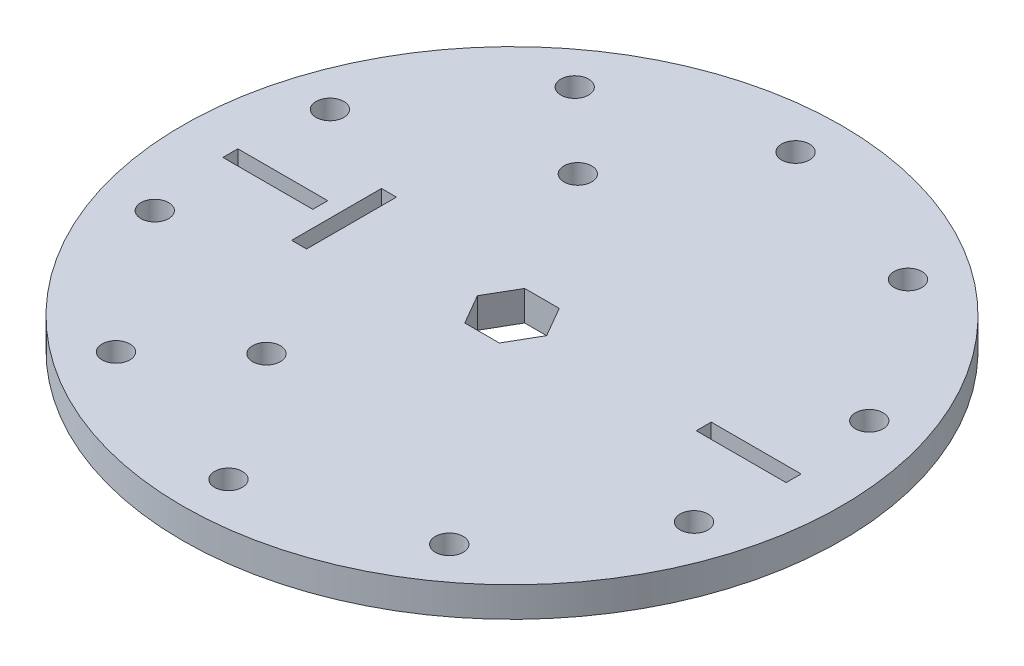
SolidWorks part; units mm, degrees
ref_plane "Front Plane" through (0, 0, 0) normal (0, 0, 1) x (1, 0, 0)
ref_plane "Top Plane" through (0, 0, 0) normal (0, 1, 0) x (1, 0, 0)
ref_plane "Right Plane" through (0, 0, 0) normal (1, 0, 0) x (0, 0, -1)
sketch "Sketch1" plane through (0, 0, 0) normal (0, 1, 0) x (1, 0, 0)
  line L1 (1.8331, 3.175) -> (-1.8331, 3.175)
  line L2 (-1.8331, 3.175) -> (-3.6662, 0)
  line L3 (-3.6662, 0) -> (-1.8331, -3.175)
  line L4 (-1.8331, -3.175) -> (1.8331, -3.175)
  line L5 (1.8331, -3.175) -> (3.6662, 0)
  line L6 (3.6662, 0) -> (1.8331, 3.175)
  circle A0 centre (0, 0) radius 34.925
  circle A1 centre (0, 0) radius 3.175 construction
  dimension "D1" = 69.85
  dimension "D2" = 6.35
extrude "Boss-Extrude1" add sketch "Sketch1" along normal blind 3.175
hole_wizard "#4 Clearance Hole1" positions "Sketch4" profile "Sketch2" hole size "#4" standard "ANSI Inch"
sketch "Sketch4" plane through (0, 3.175, 0) normal (0, 1, 0) x (1, 0, 0)
  line L1 (0, 30.0455) -> (-17.6603, 24.3073) construction
  line L2 (-17.6603, 24.3073) -> (-28.575, 9.2846) construction
  line L3 (-28.575, 9.2846) -> (-28.575, -9.2846) construction
  line L4 (-28.575, -9.2846) -> (-17.6603, -24.3073) construction
  line L5 (-17.6603, -24.3073) -> (0, -30.0455) construction
  line L6 (0, -30.0455) -> (17.6603, -24.3073) construction
  line L7 (17.6603, -24.3073) -> (28.575, -9.2846) construction
  line L8 (28.575, -9.2846) -> (28.575, 9.2846) construction
  line L9 (28.575, 9.2846) -> (17.6603, 24.3073) construction
  line L10 (17.6603, 24.3073) -> (0, 30.0455) construction
  line L12 (0, 0) -> (28.575, 9.2846) construction
  line L20 (34.925, 0) -> (0, 0) construction
  circle A0 centre (0, 0) radius 28.575 construction
  circle A1 centre (0, 0) radius 34.925 construction
  point P3 (0, 30.0455)
  point P4 (-17.6603, 24.3073)
  point P5 (-28.575, 9.2846)
  point P6 (-28.575, -9.2846)
  point P7 (-17.6603, -24.3073)
  point P8 (0, -30.0455)
  point P9 (17.6603, -24.3073)
  point P10 (28.575, -9.2846)
  point P11 (28.575, 9.2846)
  point P12 (17.6603, 24.3073)
  dimension "D1" = 57.15
  dimension "D2" = 18
sketch "Sketch2" plane through (0, 3.175, -30.0455) normal (1, 0, 0) x (0, 0, 1)
  line L0 (0, 0) -> (0, 3.175)
  line L1 (0, 3.175) -> (1.4732, 3.175)
  line L2 (1.4732, 3.175) -> (1.4732, 0)
  line L5 (1.4732, 0) -> (0, 0)
  line L11 (0, -6.35) -> (0, 107.95) construction
  dimension "Thru Hole Dia." = 2.9464
  dimension "Thru Hole Depth" = 3.175
hole_wizard "#4 Clearance Hole4" positions "Sketch9" profile "Sketch8" hole size "#4" standard "ANSI Inch"
sketch "Sketch9" plane through (0, 3.175, 0) normal (0, 1, 0) x (1, 0, 0)
  line L0 (0, 0) -> (-9.525, 0) construction
  line L1 (-9.525, 16.4978) -> (-9.525, -16.4978) construction
  line L2 (0, 0) -> (-9.525, 16.4978) construction
  line L3 (0, 0) -> (-9.525, -16.4978) construction
  point P5 (-9.525, 16.4978)
  point P6 (-9.525, -16.4978)
  point P14 (-9.525, 0)
  dimension "D1" = 120
  dimension "D2" = 19.05
sketch "Sketch8" plane through (-9.525, 3.175, -16.4978) normal (1, 0, 0) x (0, 0, 1)
  line L0 (0, 0) -> (0, 3.175)
  line L1 (0, 3.175) -> (1.4732, 3.175)
  line L2 (1.4732, 3.175) -> (1.4732, 0)
  line L5 (1.4732, 0) -> (0, 0)
  line L11 (0, -6.35) -> (0, 107.95) construction
  dimension "Thru Hole Dia." = 2.9464
  dimension "Thru Hole Depth" = 3.175
sketch "Sketch5" plane through (0, 3.175, 0) normal (0, 1, 0) x (1, 0, 0)
  line L0 (-34.925, 0) -> (34.925, 0) construction
  line L1 (0, 3.175) -> (0, -3.175) construction
  line L2 (-29.845, 0.7938) -> (-20.32, 0.7937)
  line L3 (-29.845, 0.7938) -> (-29.845, -0.7937)
  line L4 (-29.845, -0.7937) -> (-20.32, -0.7937)
  line L5 (-20.32, 0.7937) -> (-20.32, -0.7937)
  line L6 (1.8331, 3.175) -> (-1.8331, 3.175) construction
  line L7 (-1.8331, -3.175) -> (1.8331, -3.175) construction
  line L8 (20.32, 0.7937) -> (20.32, -0.7937)
  line L9 (29.845, -0.7937) -> (20.32, -0.7937)
  line L10 (29.845, 0.7937) -> (29.845, -0.7937)
  line L11 (29.845, 0.7937) -> (20.32, 0.7937)
  circle A0 centre (0, 0) radius 34.925 construction
  point P10 (-20.32, 0)
  dimension "D1" = 9.525
  dimension "D2" = 1.5875
  dimension "D3" = 5.08
extrude "Cut-Extrude1" cut sketch "Sketch5" against normal through all
sketch "Sketch10" plane through (0, 3.175, 0) normal (0, 1, 0) x (1, 0, 0)
  line L0 (-20.32, -0.7937) -> (-20.32, 0.7937) construction
  line L1 (-18.5938, 4.7625) -> (-17.0063, 4.7625)
  line L2 (-18.5938, 4.7625) -> (-18.5938, -4.7625)
  line L3 (-18.5938, -4.7625) -> (-17.0063, -4.7625)
  line L4 (-17.0063, 4.7625) -> (-17.0063, -4.7625)
  line L5 (-20.32, 0.7937) -> (-29.845, 0.7938) construction
  point P4 (-17.0063, 0)
extrude "Cut-Extrude2" cut sketch "Sketch10" against normal through all
